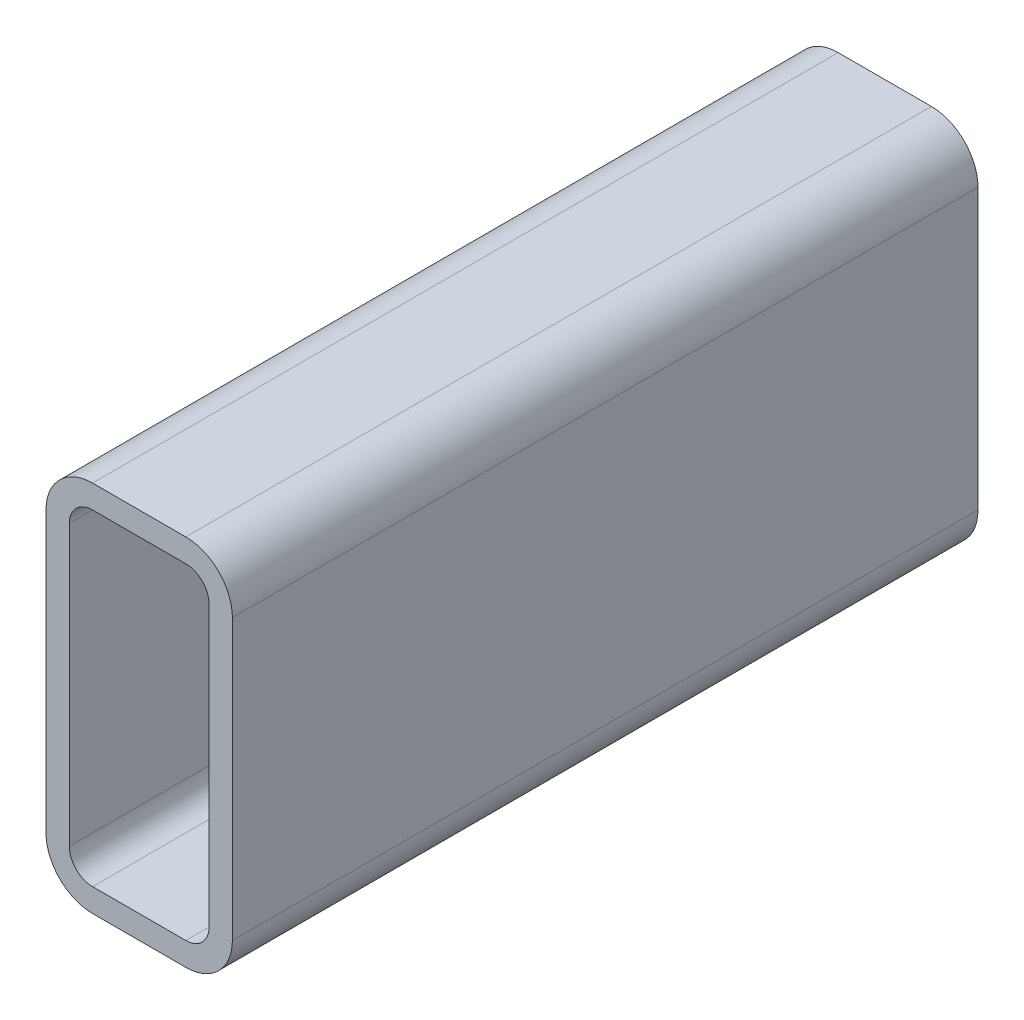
SolidWorks part; units mm, degrees
ref_plane "Front Plane" through (0, 0, 0) normal (0, 0, 1) x (1, 0, 0)
ref_plane "Top Plane" through (0, 0, 0) normal (0, 1, 0) x (1, 0, 0)
ref_plane "Right Plane" through (0, 0, 0) normal (1, 0, 0) x (0, 0, -1)
sketch "Sketch1" plane through (0, 0, 0) normal (0, 0, 1) x (1, 0, 0)
sketch_block_instance "HSS6x3x0.375-1"
sketch_block "HSS6x3x0.375"
extrude "Boss-Extrude1" add sketch "Sketch1" along normal blind 304.8
